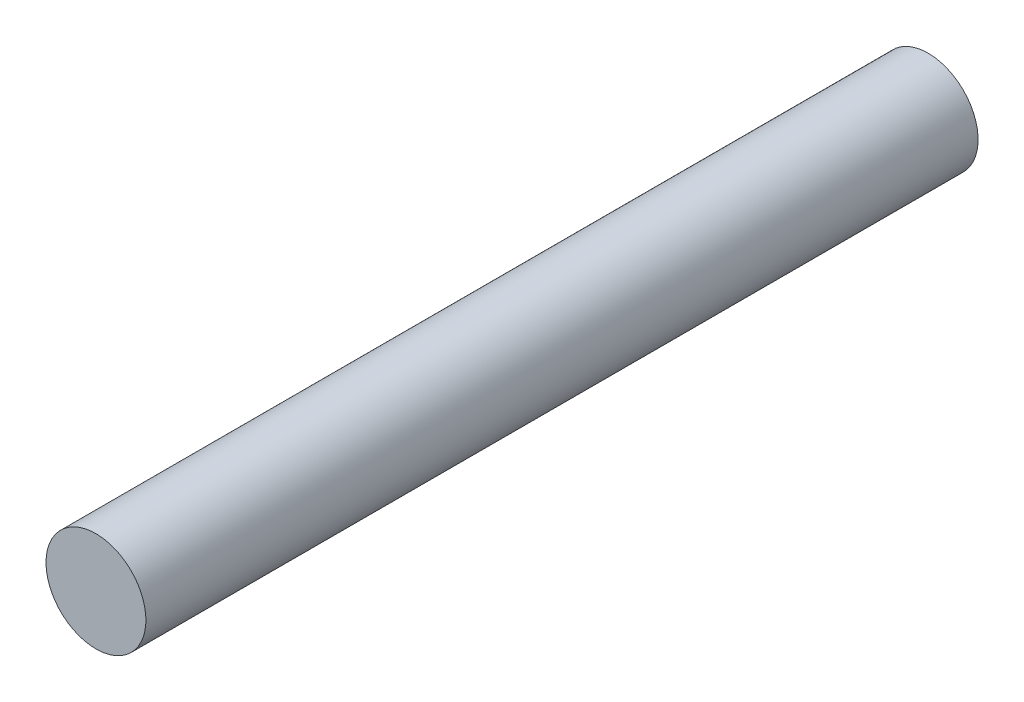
SolidWorks part; units mm, degrees
ref_plane "Plan de face" through (0, 0, 0) normal (0, 0, 1) x (1, 0, 0)
ref_plane "Plan de dessus" through (0, 0, 0) normal (0, 1, 0) x (1, 0, 0)
ref_plane "Plan de droite" through (0, 0, 0) normal (1, 0, 0) x (0, 0, -1)
sketch "Esquisse1" plane through (0, 0, 0) normal (0, 0, 1) x (1, 0, 0)
  circle A0 centre (0, 0) radius 3
  dimension "D1" = 6
extrude "Extrusion1" add sketch "Esquisse1" along normal blind 50
